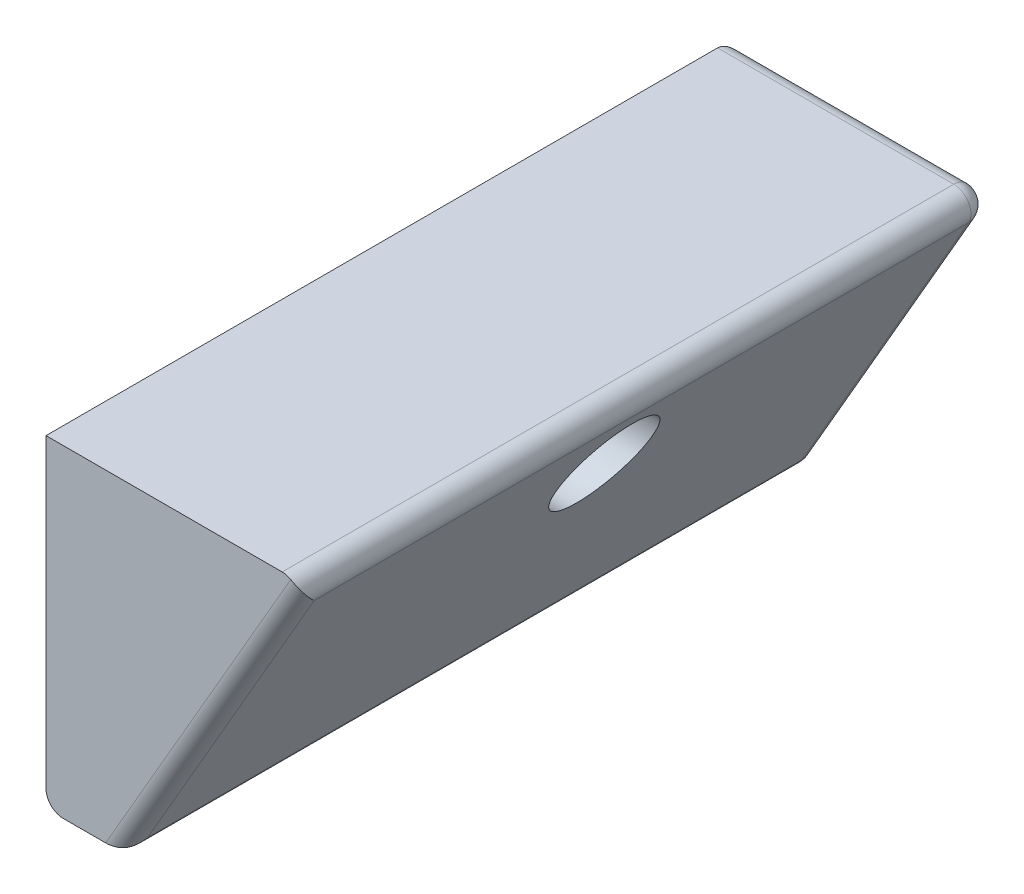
SolidWorks part; units mm, degrees
ref_plane "前视基准面" through (0, 0, 0) normal (0, 0, 1) x (1, 0, 0)
ref_plane "上视基准面" through (0, 0, 0) normal (0, 1, 0) x (1, 0, 0)
ref_plane "右视基准面" through (0, 0, 0) normal (1, 0, 0) x (0, 0, -1)
sketch "草图1" plane through (0, 0, 0) normal (0, 0, 1) x (1, 0, 0)
  line L0 (37.3351, -277.981) -> (37.3351, -259.2271)
  line L1 (37.3351, -259.2271) -> (52.7814, -259.2271)
  line L2 (52.7814, -259.2271) -> (41.9539, -277.981)
  line L3 (39.8097, -281.6947) -> (39.3347, -282.5174) construction
  line L4 (37.3351, -233.2312) -> (37.3351, -277.8759) construction
  line L5 (37.3351, -277.981) -> (41.9539, -277.981)
extrude "凸台-拉伸1" add sketch "草图1" along normal mid plane 40
sketch "草图3" plane through (0, 0, 0) normal (1, 0, 0) x (0, 0, -1)
  circle A0 centre (0.0706, -264.34) radius 1.65
  arc A1 (0, -265.588) -> (0, -263.092) centre (0.0706, -264.34) ccw construction
extrude "切除-拉伸2" cut sketch "草图3" along normal blind 56
sketch "草图4" plane through (0, 0, 0) normal (1, 0, 0) x (0, 0, -1)
  circle A0 centre (-0.0706, -264.34) radius 2.8
extrude "切除-拉伸3" cut sketch "草图4" along normal blind 56 from offset 45 contours A0
fillet "圆角1" radius 1 8 edges at (37.3351, -268.604, -20) (39.6445, -277.981, -20) (47.3676, -268.604, -20) (45.0582, -259.2271, -20) (37.3351, -277.981, 0) (41.9539, -277.981, 0) (52.7814, -259.2271, 0) (47.3676, -268.604, 20)
